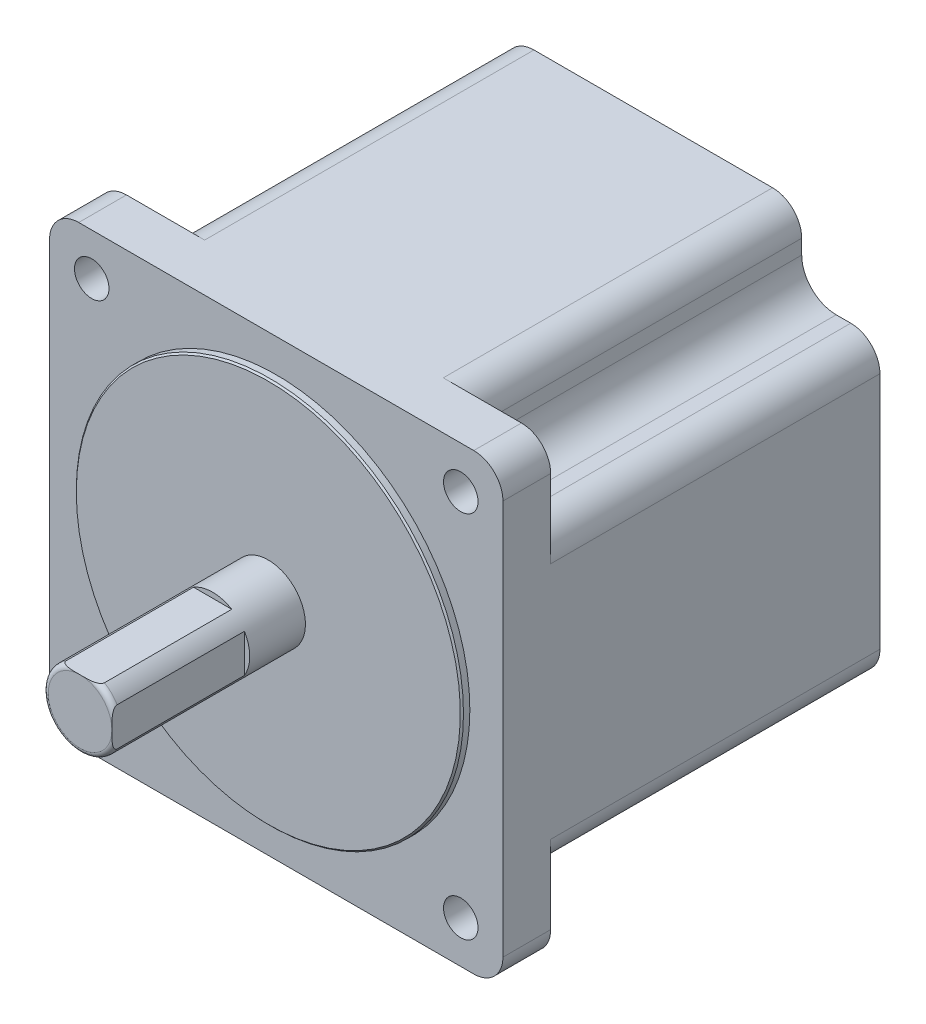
SolidWorks part; units mm, degrees
ref_plane "正面" through (0, 0, 0) normal (0, 0, 1) x (1, 0, 0)
ref_plane "平面" through (0, 0, 0) normal (0, 1, 0) x (1, 0, 0)
ref_plane "右側面" through (0, 0, 0) normal (1, 0, 0) x (0, 0, -1)
sketch "ｽｹｯﾁ1" plane through (0, 0, 0) normal (0, 0, 1) x (1, 0, 0)
  circle A0 centre (0, 0) radius 7
  dimension "D1" = 14
extrude "押し出し1" add sketch "ｽｹｯﾁ1" along normal blind 35.5
sketch "ｽｹｯﾁ2" plane through (0, 0, 0) normal (0, 0, -1) x (-1, 0, 0)
  circle A0 centre (0, 0) radius 36.5125
  dimension "D1" = 73.025
extrude "押し出し2" add sketch "ｽｹｯﾁ2" along normal blind 1.5
sketch "ｽｹｯﾁ3" plane through (0, 0, -1.5) normal (0, 0, -1) x (-1, 0, 0)
  line L1 (-42.75, 42.75) -> (42.75, 42.75)
  line L2 (-42.75, 42.75) -> (-42.75, -42.75)
  line L3 (-42.75, -42.75) -> (42.75, -42.75)
  line L4 (42.75, 42.75) -> (42.75, -42.75)
  line L5 (-42.75, 42.75) -> (42.75, -42.75) construction
  line L6 (-42.75, -42.75) -> (42.75, 42.75) construction
  line L7 (34.8, 34.8) -> (-34.8, 34.8) construction
  line L8 (34.8, 34.8) -> (34.8, -34.8) construction
  line L9 (34.8, -34.8) -> (-34.8, -34.8) construction
  line L10 (-34.8, 34.8) -> (-34.8, -34.8) construction
  line L11 (34.8, 34.8) -> (-34.8, -34.8) construction
  line L12 (34.8, -34.8) -> (-34.8, 34.8) construction
  circle A0 centre (34.8, 34.8) radius 3.25
  circle A1 centre (-34.8, 34.8) radius 3.25
  circle A2 centre (34.8, -34.8) radius 3.25
  circle A3 centre (-34.8, -34.8) radius 3.25
  point P0 (0, 0)
  point P6 (0, 0)
  dimension "D3" = 69.6
  dimension "D4" = 69.6
  dimension "D6" = 6.5
  dimension "D1" = 85.5
  dimension "D2" = 85.5
extrude "押し出し3" add sketch "ｽｹｯﾁ3" along normal blind 9
fillet "Fillet1" radius 5.5 4 edges at (42.75, -42.75, -6) (-42.75, -42.75, -6) (-42.75, 42.75, -6) (42.75, 42.75, -6)
sketch "ｽｹｯﾁ4" plane through (0, 0, -10.5) normal (0, 0, -1) x (-1, 0, 0)
  line L0 (28, 28) -> (42.75, 28)
  line L1 (-28, 42.75) -> (28, 42.75)
  line L2 (-28, 42.75) -> (-28, 28)
  line L3 (-28, -42.75) -> (28, -42.75)
  line L4 (28, 42.75) -> (28, 28)
  line L5 (-28, 42.75) -> (28, -42.75) construction
  line L6 (-28, -42.75) -> (28, 42.75) construction
  line L7 (-42.75, 28) -> (-28, 28)
  line L8 (-42.75, 28) -> (-42.75, -28)
  line L9 (-42.75, -28) -> (-28, -28)
  line L10 (42.75, 28) -> (42.75, -28)
  line L11 (-42.75, 28) -> (42.75, -28) construction
  line L12 (-42.75, -28) -> (42.75, 28) construction
  line L13 (-28, -28) -> (-28, -42.75)
  line L14 (28, -28) -> (42.75, -28)
  line L15 (28, -28) -> (28, -42.75)
  point P0 (0, 0)
  point P6 (0, 0)
  dimension "D1" = 56
  dimension "D2" = 85.5
  dimension "D3" = 85.5
  dimension "D4" = 56
extrude "押し出し4" add sketch "ｽｹｯﾁ4" along normal blind 62.1
fillet "Fillet2" radius 6.5 4 edges at (28, -28, -41.55) (-28, -28, -41.55) (-28, 28, -41.55) (28, 28, -41.55)
fillet "Fillet3" radius 5.5 8 edges
sketch "Sketch1" plane through (0, -42.75, 0) normal (0, -1, 0) x (1, 0, 0)
  line L0 (22.5, -72.6) -> (-22.5, -72.6) construction
  line L1 (-13.25, -72.6) -> (13.25, -72.6)
  line L2 (-13.25, -72.6) -> (-13.25, -51.6)
  line L3 (-13.25, -51.6) -> (13.25, -51.6)
  line L4 (13.25, -72.6) -> (13.25, -51.6)
  dimension "D1" = 21
  dimension "D2" = 26.5
  dimension "D3" = 13.25
extrude "Extrude1" add sketch "Sketch1" along normal blind 12
sketch "Sketch5" plane through (13.25, 0, 0) normal (1, 0, 0) x (0, 0, -1)
  line L0 (72.6, -47.75) -> (64, -54.75)
  line L3 (72.6, -54.75) -> (72.6, -42.75) construction
  line L4 (72.6, -54.75) -> (51.6, -54.75) construction
  line L6 (64, -54.75) -> (72.6, -54.75)
  line L8 (72.6, -54.75) -> (72.6, -47.75)
  dimension "D1" = 7
  dimension "D2" = 8.6
extrude "Extrude4" cut sketch "Sketch5" against normal through all and the other way through all
sketch "Sketch6" plane through (0, 0, -51.6) normal (0, 0, 1) x (1, 0, 0)
  line L0 (-13.25, -49.75) -> (-13.25, -54.75)
  line L2 (-13.25, -49.75) -> (-13.25, -54.75)
  line L3 (-13.25, -54.75) -> (-7.5, -54.75)
  line L4 (13.25, -54.75) -> (-13.25, -54.75) construction
  line L5 (-7.5, -54.75) -> (-13.25, -49.75)
  line L6 (13.25, -49.75) -> (13.25, -54.75)
  line L7 (13.25, -54.75) -> (13.25, -42.75) construction
  line L8 (13.25, -54.75) -> (7.5, -54.75)
  line L9 (7.5, -54.75) -> (13.25, -49.75)
  dimension "D1" = 5
  dimension "D2" = 7.5
  dimension "D3" = 15
  dimension "D4" = 5
extrude "Extrude5" cut sketch "Sketch6" against normal through all contours L5 M3 M2 | L9 M3 M4
fillet "Fillet4" radius 1 1 edges at (7, 0, 35.5)
sketch "Sketch2" plane through (0, 0, 35.5) normal (0, 0, 1) x (1, 0, 0)
  line L1 (-7, 8) -> (7, 8)
  line L2 (-7, 8) -> (-7, 6)
  line L3 (-7, 6) -> (7, 6)
  line L4 (7, 8) -> (7, 6)
  line L5 (8, -8) -> (6, -8)
  line L6 (8, -8) -> (8, 6)
  line L7 (8, 6) -> (6, 6)
  line L8 (6, -8) -> (6, 6)
  circle A0 centre (0, 0) radius 7 construction
  dimension "D1" = 6
  dimension "D2" = 14
  dimension "D3" = 2
  dimension "D4" = 7
  dimension "D5" = 6
  dimension "D6" = 2
  dimension "D7" = 14
extrude "Extrude2" cut sketch "Sketch2" against normal blind 25 contours L4 L1 L2 L3 | L6 L7 L8 L5
chamfer "Chamfer2" distance 0.3 angle 45 1 edges at (-36.5125, 0, 0)
sketch "Sketch3" plane through (0, 0, -1.5) normal (0, 0, 1) x (1, 0, 0)
  circle A0 centre (0, 0) radius 18
  circle A1 centre (0, 0) radius 24.35
  dimension "D1" = 48.7
  dimension "D2" = 36
extrude "Extrude3" cut sketch "Sketch3" against normal blind 0.2
chamfer "Chamfer3" distance 0.2 distance2 0.4 1 edges at (24.35, 0, -1.7)
